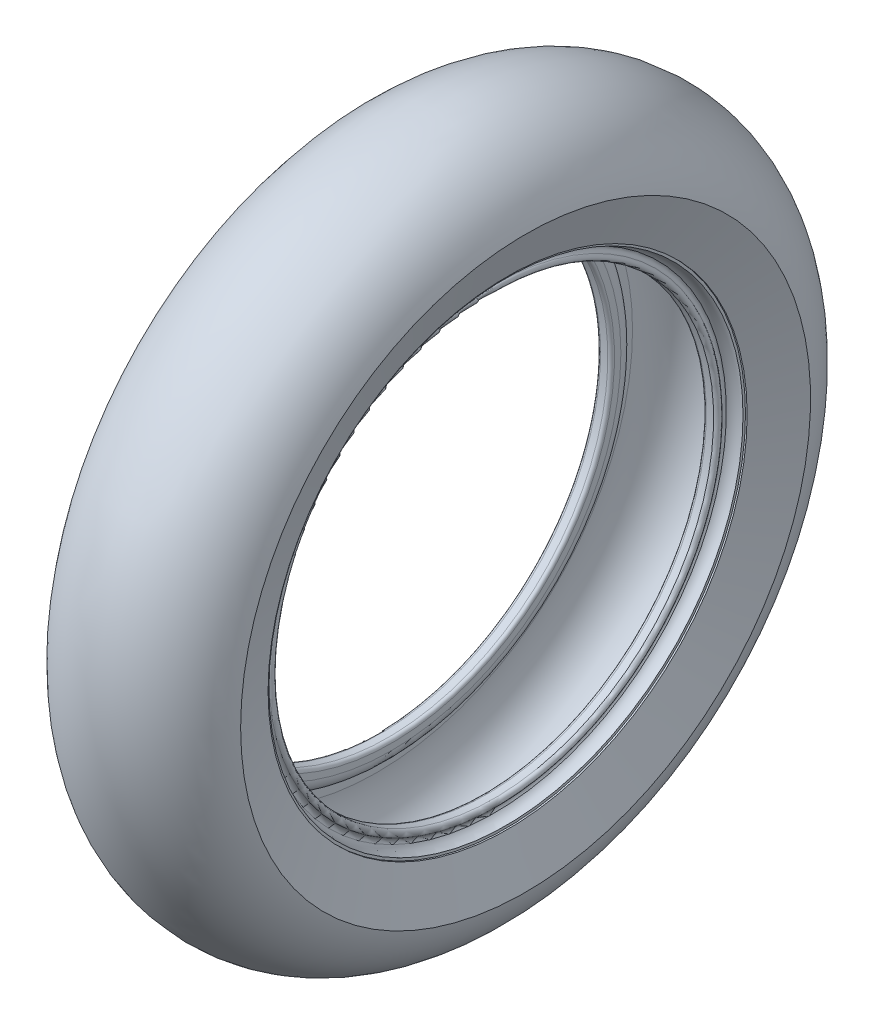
SolidWorks part; units mm, degrees
ref_plane "Face" through (0, 0, 0) normal (0, 0, 1) x (1, 0, 0)
ref_plane "Dessus" through (0, 0, 0) normal (0, 1, 0) x (1, 0, 0)
ref_plane "Droite" through (0, 0, 0) normal (1, 0, 0) x (0, 0, -1)
sketch "Esquisse1" plane through (0, 0, 0) normal (0, 0, 1) x (1, 0, 0)
  line L0 (-62.5917, 0) -> (104.7496, 0) construction
  line L1 (-53.5, 172.2648) -> (-42.6268, 144.8056)
  line L2 (0, -25.079) -> (0, 252.1571) construction
  line L3 (42.6268, 144.8056) -> (53.5, 172.2648)
  line L4 (-34.1696, 133.0056) -> (-29.771, 133.0056)
  line L5 (-41.6268, 143.3056) -> (-41.6268, 144.8056)
  line L6 (-41.6268, 144.8056) -> (-42.6268, 144.8056)
  line L7 (-36.3167, 147.4786) -> (-36.3167, 154.4745)
  line L8 (-27.771, 138.8693) -> (-27.771, 135.0056)
  line L9 (27.771, 138.8693) -> (27.771, 135.0056)
  line L11 (41.6268, 144.8056) -> (42.6268, 144.8056)
  line L12 (41.6268, 143.3056) -> (41.6268, 144.8056)
  line L13 (34.1696, 133.0056) -> (29.771, 133.0056)
  line L14 (36.3167, 154.4745) -> (36.3167, 147.4786)
  arc A0 (-41.6268, 143.3056) -> (-34.5957, 140.2637) centre (-40.9, 135.3387) cw
  arc A1 (-53.5, 172.2648) -> (53.5, 172.2648) centre (0, 157.5) cw
  arc A2 (36.3167, 154.4745) -> (-36.3167, 154.4745) centre (0, 157.5) ccw
  arc A3 (-35.2333, 136.9163) -> (-34.1696, 133.0056) centre (-34.1696, 135.1056) ccw
  arc A4 (-34.5957, 140.2637) -> (-35.2333, 136.9163) centre (-36.3806, 138.8693) cw
  arc A5 (-36.3167, 147.4786) -> (-27.771, 138.8693) centre (-36.3806, 138.8693) cw
  arc A6 (-29.771, 133.0056) -> (-27.771, 135.0056) centre (-29.771, 135.0056) ccw
  arc A8 (29.771, 133.0056) -> (27.771, 135.0056) centre (29.771, 135.0056) cw
  arc A9 (36.3167, 147.4786) -> (27.771, 138.8693) centre (36.3806, 138.8693) ccw
  arc A10 (34.5957, 140.2637) -> (35.2333, 136.9163) centre (36.3806, 138.8693) ccw
  arc A11 (35.2333, 136.9163) -> (34.1696, 133.0056) centre (34.1696, 135.1056) cw
  arc A13 (41.6268, 143.3056) -> (34.5957, 140.2637) centre (40.9, 135.3387) ccw
  dimension "D1" = 426
  dimension "D5" = 55.5
  dimension "D6" = 4.2
  dimension "D7" = 11.8
  dimension "D11" = 8
  dimension "D12" = 2.265
  dimension "D17" = 8.6096
  dimension "D18" = 2
  dimension "D2" = 107
  dimension "D9" = 34.1696
  dimension "D10" = 41.6268
  dimension "D13" = 1.5
  dimension "D14" = 1
  dimension "D15" = 40.9
revolve "Base-Révolution" add sketch "Esquisse1" angle 360 about L0
sketch "Esquisse2" plane through (0, 0, 0) normal (0, 1, 0) x (1, 0, 0)
  line L1 (0, 247.9635) -> (41.553, 247.9635)
  line L2 (0, 247.9635) -> (0, 194.2913)
  line L3 (0, 194.2913) -> (41.553, 194.2913)
  line L4 (41.553, 247.9635) -> (41.553, 194.2913)
  arc A0 (53.5, 172.2648) -> (-53.5, 172.2648) centre (0, 157.5) ccw construction
extrude "Enlèv. mat.-Extru.1" cut sketch "Esquisse2" against normal blind 10
